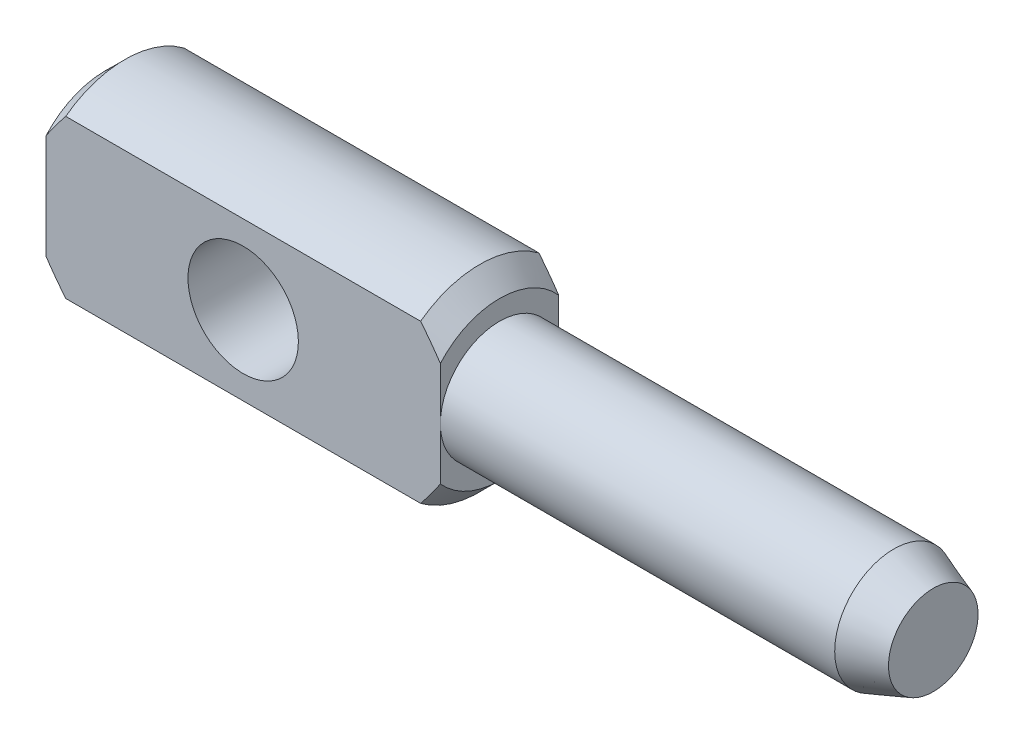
SolidWorks part; units mm, degrees
ref_plane "Front Plane" through (0, 0, 0) normal (0, 0, 1) x (1, 0, 0)
ref_plane "Top Plane" through (0, 0, 0) normal (0, 1, 0) x (1, 0, 0)
ref_plane "Right Plane" through (0, 0, 0) normal (1, 0, 0) x (0, 0, -1)
sketch "Sketch1" plane through (0, 0, 0) normal (0, 0, 1) x (1, 0, 0)
  line L0 (0, 0) -> (21, 0) construction
  line L1 (0, 0) -> (0, 2)
  line L2 (0.5, 2.5) -> (9.5, 2.5)
  line L3 (10, 2) -> (10, 1.5)
  line L4 (10, 1.5) -> (20, 1.5)
  line L5 (20, 1.5) -> (21, 1.136)
  line L6 (21, 1.136) -> (21, 0)
  line L7 (0, 2) -> (0.5, 2.5)
  line L8 (9.5, 2.5) -> (10, 2)
  line L9 (0, 0) -> (21, 0)
  point P4 (0, 2.5)
  point P5 (10, 2.5)
  dimension "D1" = 5
  dimension "D2" = 3
  dimension "D3" = 1
  dimension "L1" = 10
  dimension "L2" = 11
  dimension "D4" = 20
revolve "Revolve1" add sketch "Sketch1" angle 360 about L0
sketch "Sketch2" plane through (0, 0, 0) normal (-1, 0, 0) x (0, 0, 1)
  line L1 (-1.5, -2.5) -> (1.5, -2.5)
  line L2 (-1.5, -2.5) -> (-1.5, 2.5)
  line L3 (-1.5, 2.5) -> (1.5, 2.5)
  line L4 (1.5, -2.5) -> (1.5, 2.5)
  line L5 (-1.5, -2.5) -> (1.5, 2.5) construction
  line L6 (-1.5, 2.5) -> (1.5, -2.5) construction
  circle A0 centre (0, 0) radius 2.5 construction
  point P0 (0, 0)
  dimension "E" = 3
extrude "Cut-Extrude1" cut sketch "Sketch2" against normal blind 19 flip side to cut
sketch "Sketch4" plane through (0, 0, 1.5) normal (0, 0, 1) x (1, 0, 0)
  circle A0 centre (5, 0) radius 1.4
  dimension "F1" = 2.8
  dimension "H1" = 5
extrude "Cut-Extrude2" cut sketch "Sketch4" against normal through all
